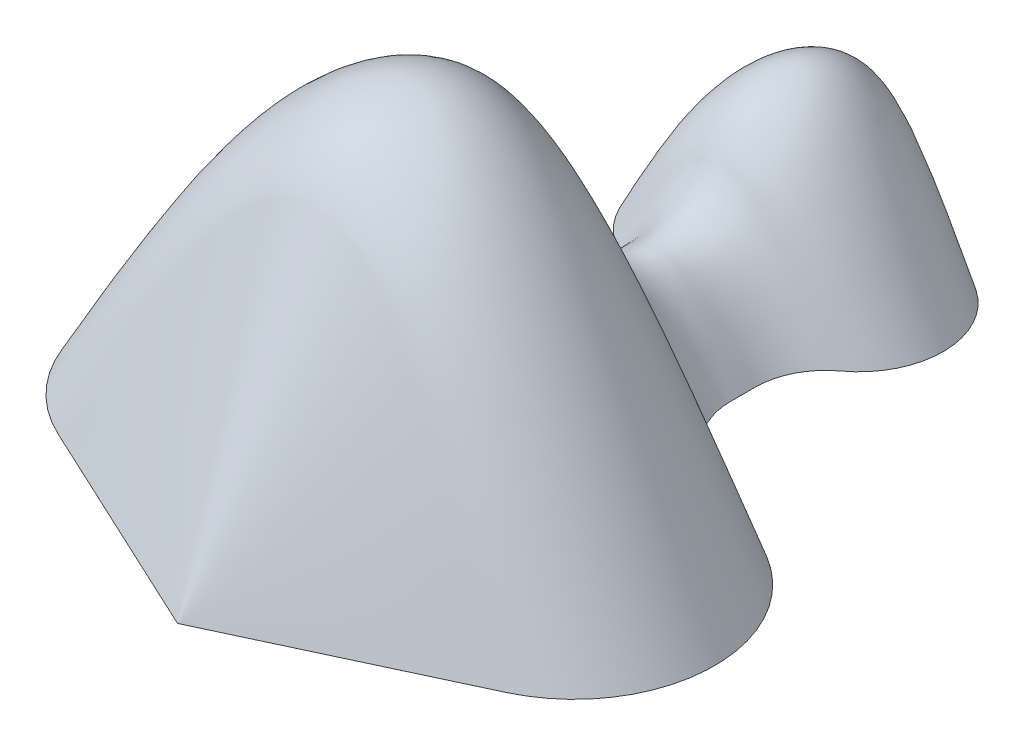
SolidWorks part; units mm, degrees
ref_plane "Front Plane" through (0, 0, 0) normal (0, 0, 1) x (1, 0, 0)
ref_plane "Top Plane" through (0, 0, 0) normal (0, 1, 0) x (1, 0, 0)
ref_plane "Right Plane" through (0, 0, 0) normal (1, 0, 0) x (0, 0, -1)
sketch "Source" plane through (0, 0, 0) normal (0, 1, 0) x (1, 0, 0)
  line L0 (0, 0) -> (0, 100)
  line L1 (0, 0) -> (-31.8971, 14.8738)
  line L2 (-31.8971, 51.1262) -> (-17.7738, 57.7119)
  line L3 (-12, 66.775) -> (-12, 70.2518)
  line L4 (0, 100) -> (-9, 100)
  line L5 (0, 100) -> (0, 122.3289) construction
  line L6 (-23.4447, 33) -> (0, 33) construction
  arc A0 (-31.8971, 14.8738) -> (-31.8971, 51.1262) centre (-23.4447, 33) cw
  arc A1 (-9, 100) -> (-16.0909, 78.3191) centre (-9, 88) ccw
  arc A2 (-12, 66.775) -> (-17.7738, 57.7119) centre (-22, 66.775) cw
  arc A3 (-16.0909, 78.3191) -> (-12, 70.2518) centre (-22, 70.2518) cw
  dimension "D1" = 42
  dimension "D3" = 12
  dimension "D4" = 20
  dimension "D7" = 55
  dimension "D8" = 10
  dimension "D2" = 24
  dimension "D5" = 65
  dimension "D6" = 100
sketch "Copied" plane through (0, 0.6247, 0.3233) normal (1, 0, 0) x (0, -1, 0)
  line L0 (0.6247, 0.3233) -> (0.6247, 100.3233)
  line L1 (0.6247, 0.3233) -> (-40.9903, 19.7287)
  line L2 (-40.9903, 46.918) -> (-17.6491, 57.8021)
  line L3 (-11.8753, 66.8652) -> (-11.8753, 68.4802)
  line L4 (0.6247, 100.3233) -> (-12.3753, 100.3233)
  line L5 (0.6247, 100.3233) -> (0.6247, 122.6523) construction
  line L6 (-34.651, 33.3233) -> (0.6247, 33.3233) construction
  arc A0 (-40.9903, 19.7287) -> (-40.9903, 46.918) centre (-34.651, 33.3233) cw
  arc A1 (-12.3753, 100.3233) -> (-17.5571, 77.4998) centre (-12.3753, 88.3233) ccw
  arc A2 (-11.8753, 66.8652) -> (-17.6491, 57.8021) centre (-21.8753, 66.8652) cw
  arc A3 (-17.5571, 77.4998) -> (-11.8753, 68.4802) centre (-21.8753, 68.4802) cw
  dimension "D1" = 25
  dimension "D3" = 12
  dimension "D4" = 15
  dimension "D7" = 55
  dimension "D8" = 10
  dimension "D2" = 12.5
  dimension "D5" = 65
  dimension "D6" = 100
sketch "Sketch2" plane through (0, 0, 0) normal (0, -1, 0) x (-1, 0, 0)
  line L0 (0, 0) -> (0, 100)
  line L1 (0, 0) -> (-31.8971, 14.8738)
  line L2 (-31.8971, 51.1262) -> (-17.7738, 57.7119)
  line L3 (-12, 66.775) -> (-12, 70.2518)
  line L4 (0, 100) -> (-9, 100)
  line L5 (0, 100) -> (0, 122.3289) construction
  line L6 (-23.4447, 33) -> (0, 33) construction
  arc A0 (-31.8971, 14.8738) -> (-31.8971, 51.1262) centre (-23.4447, 33) cw
  arc A1 (-9, 100) -> (-16.0909, 78.3191) centre (-9, 88) ccw
  arc A2 (-12, 66.775) -> (-17.7738, 57.7119) centre (-22, 66.775) cw
  arc A3 (-16.0909, 78.3191) -> (-12, 70.2518) centre (-22, 70.2518) cw
other "Boundary1"
